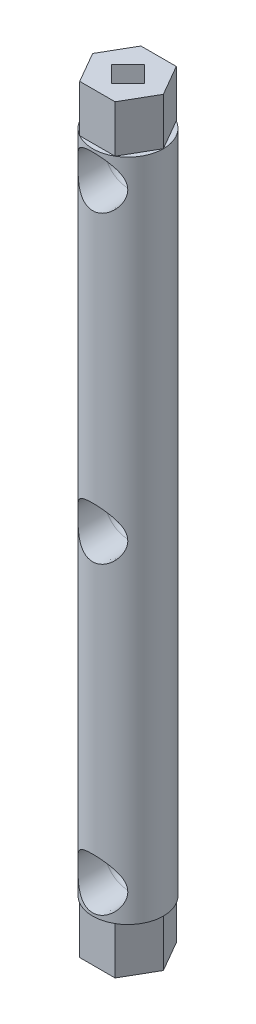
SolidWorks part; units mm, degrees
ref_plane "Front Plane" through (0, 0, 0) normal (0, 0, 1) x (1, 0, 0)
ref_plane "Top Plane" through (0, 0, 0) normal (0, 1, 0) x (1, 0, 0)
ref_plane "Right Plane" through (0, 0, 0) normal (1, 0, 0) x (0, 0, -1)
sketch "Sketch1" plane through (0, 0, 0) normal (0, 1, 0) x (1, 0, 0)
  circle A0 centre (0, 0) radius 7.5
extrude "Boss-Extrude1" add sketch "Sketch1" along normal blind 141
sketch "Sketch2" plane through (0, 0, 0) normal (0, 0, 1) x (1, 0, 0)
  line L0 (0, 141) -> (0, 135) construction
  line L1 (7.5, 141) -> (-7.5, 141) construction
  line L2 (0, 0) -> (0, 6) construction
  line L3 (0, 6) -> (0, 135) construction
  circle A0 centre (0, 135) radius 5
  circle A1 centre (0, 70.5) radius 5
  circle A2 centre (0, 6) radius 5
extrude "Cut-Extrude1" cut sketch "Sketch2" along normal through all draft 3
ref_axis "Axis1" through (0, 141, 0) along (0, -1, 0)
sketch "Sketch3" plane through (0, 0, 0) normal (0, 0, 1) x (1, 0, 0)
  line L0 (0, 11) -> (0, 1)
  line L1 (0, 75.5) -> (0, 65.5)
  line L2 (0, 140) -> (0, 130)
  arc A0 (0, 130) -> (0, 140) centre (0, 135) ccw
  arc A1 (0, 65.5) -> (0, 75.5) centre (0, 70.5) ccw
  arc A2 (0, 1) -> (0, 11) centre (0, 6) ccw
revolve "Cut-Revolve1" cut sketch "Sketch3" angle 360 about axis through (0, 141, 0) along (0, -1, 0)
sketch "Sketch4" plane through (0, 141, 0) normal (0, 1, 0) x (1, 0, 0)
  line L1 (7.5, 0) -> (3.75, 6.4952)
  line L2 (3.75, 6.4952) -> (-3.75, 6.4952)
  line L3 (-3.75, 6.4952) -> (-7.5, 0)
  line L4 (-7.5, 0) -> (-3.75, -6.4952)
  line L5 (-3.75, -6.4952) -> (3.75, -6.4952)
  line L6 (3.75, -6.4952) -> (7.5, 0)
  circle A0 centre (0, 0) radius 6.4952 construction
extrude "Boss-Extrude2" add sketch "Sketch4" along normal blind 10
sketch "Sketch5" plane through (0, 0, 0) normal (0, -1, 0) x (-1, 0, 0)
  line L1 (-7.5, 0) -> (-3.75, -6.4952)
  line L2 (-3.75, -6.4952) -> (3.75, -6.4952)
  line L3 (3.75, -6.4952) -> (7.5, 0)
  line L4 (7.5, 0) -> (3.75, 6.4952)
  line L5 (3.75, 6.4952) -> (-3.75, 6.4952)
  line L6 (-3.75, 6.4952) -> (-7.5, 0)
  circle A0 centre (0, 0) radius 6.4952 construction
extrude "Boss-Extrude3" add sketch "Sketch5" along normal blind 10
hole_wizard "#10 (0.1935) Diameter Hole1" positions "Sketch7" profile "Sketch6" hole size "#10" standard "ANSI Inch"
sketch "Sketch7" plane through (0, 151, 0) normal (0, 1, 0) x (1, 0, 0)
  point P0 (0, 0)
sketch "Sketch6" plane through (0, 151, 0) normal (1, 0, 0) x (0, 0, 1)
  line L0 (0, 0) -> (0, 6.4766)
  line L1 (0, 6.4766) -> (2.4574, 5)
  line L2 (2.4574, 5) -> (2.4574, 0)
  line L5 (2.4574, 0) -> (0, 0)
  line L10 (0, 6.4766) -> (-2.4574, 5) construction
  line L11 (0, -6.35) -> (0, 107.95) construction
  dimension "Hole Dia." = 4.9149
  dimension "Hole Depth" = 5
  dimension "Drill Angle" = 118
hole_wizard "#10 (0.1935) Diameter Hole2" positions "Sketch10" profile "Sketch9" hole size "#10" standard "ANSI Inch"
sketch "Sketch10" plane through (0, -10, 0) normal (0, -1, 0) x (-1, 0, 0)
  point P0 (0, 0)
sketch "Sketch9" plane through (0, -10, 0) normal (1, 0, 0) x (0, 0, -1)
  line L0 (0, 0) -> (0, 6.4766)
  line L1 (0, 6.4766) -> (2.4574, 5)
  line L2 (2.4574, 5) -> (2.4574, 0)
  line L5 (2.4574, 0) -> (0, 0)
  line L10 (0, 6.4766) -> (-2.4574, 5) construction
  line L11 (0, -6.35) -> (0, 107.95) construction
  dimension "Hole Dia." = 4.9149
  dimension "Hole Depth" = 5
  dimension "Drill Angle" = 118
sketch "Sketch11" plane through (0, 151, 0) normal (0, 1, 0) x (1, 0, 0)
  line L0 (0, 4.4419) -> (0, -4.4225) construction
  line L1 (-4.1212, 0) -> (4.1989, 0) construction
  line L2 (0, 3.4876) -> (3.4876, 0) construction
  line L3 (0, 3.4876) -> (3.4876, 0)
  line L4 (3.4876, 0) -> (0, -3.4876)
  line L5 (0, -3.4876) -> (-3.4876, 0)
  line L6 (-3.4876, 0) -> (0, 3.4876)
  circle A0 centre (0, 0) radius 2.4574 construction
extrude "Cut-Extrude2" cut sketch "Sketch11" against normal blind 10
sketch "Sketch12" plane through (0, -10, 0) normal (0, -1, 0) x (-1, 0, 0)
  line L0 (0, -3.4876) -> (-3.4876, 0)
  line L1 (-3.4876, 0) -> (0, 3.4876)
  line L2 (0, 3.4876) -> (3.4876, 0)
  line L3 (3.4876, 0) -> (0, -3.4876)
extrude "Cut-Extrude3" cut sketch "Sketch12" against normal blind 10
